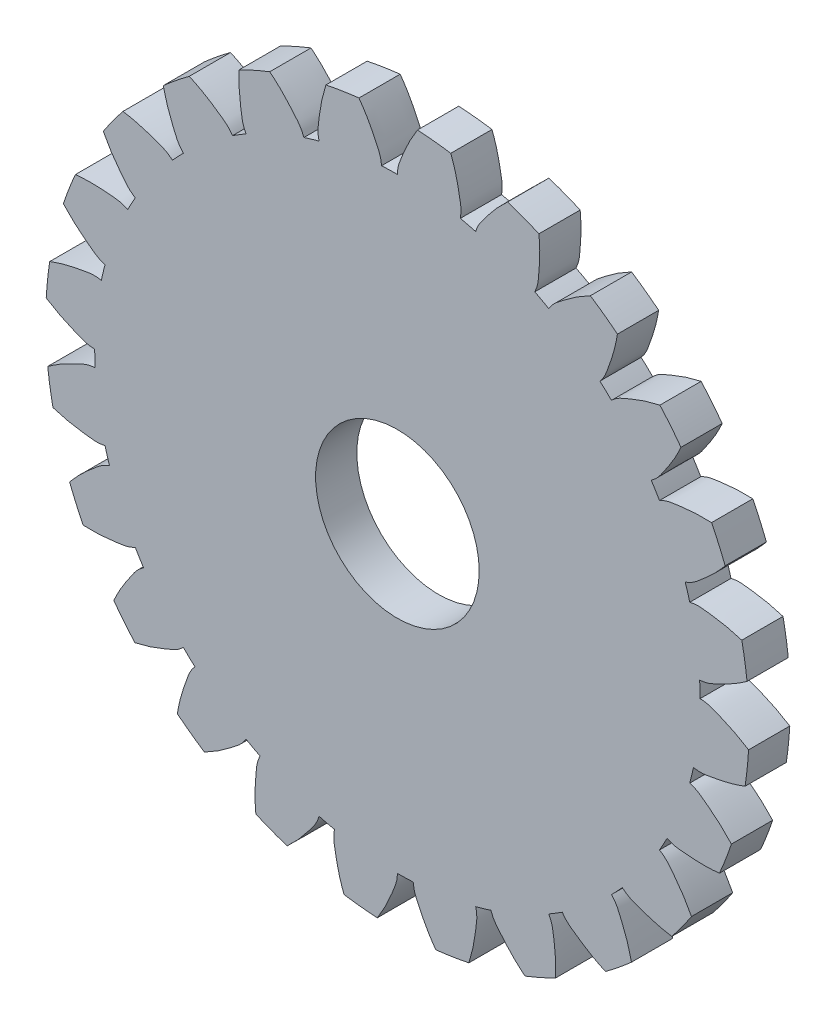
SolidWorks part; units mm, degrees
ref_plane "Front Plane" through (0, 0, 0) normal (0, 0, 1) x (1, 0, 0)
ref_plane "Top Plane" through (0, 0, 0) normal (0, 1, 0) x (1, 0, 0)
ref_plane "Right Plane" through (0, 0, 0) normal (1, 0, 0) x (0, 0, -1)
sketch "Sketch1" plane through (0, 0, 0) normal (0, 0, 1) x (1, 0, 0)
  line L0 (0, 0) -> (0, 11.7475) construction
  line L1 (6.5525, 9.7503) -> (0, 0) construction
  line L2 (0, 0) -> (2.0399, 11.569) construction
  line L3 (0.779, 13.6303) -> (6.5525, 9.7503) construction
  line L5 (0, 0) -> (1.8184, 17.3013) construction
  line L7 (2.0399, 11.569) -> (0.0138, 11.9263) construction
  line L10 (0, 0) -> (4.0179, 11.039) construction
  line L12 (0, 0) -> (5.8738, 10.1736) construction
  line L17 (4.0179, 11.039) -> (0.1751, 12.4377) construction
  line L19 (5.8738, 10.1736) -> (0.5505, 13.247) construction
  circle A0 centre (0, 0) radius 11.7475 construction
  circle A1 centre (0, 0) radius 12.7 construction
  circle A2 centre (0, 0) radius 13.6525 construction
  arc A3 (2.4424, 11.4908) -> (0, 11.7475) centre (0, 0) ccw
  arc A4 (0.779, 13.6303) -> (2.0719, 13.4944) centre (0, 0) cw
  spline S0 degree 3 poles (0, 11.7475) (0.0029, 11.8074) (0.0146, 12.0464) (0.2199, 12.5512) (0.4655, 13.1236) (0.7006, 13.5036) (0.779, 13.6303) knots 0 0 0 0 0.087308 0.348389 0.78275 1 1 1 1
  spline S1 degree 3 poles (2.4424, 11.4908) (2.452, 11.55) (2.4903, 11.7862) (2.3945, 12.3226) (2.2733, 12.9336) (2.1222, 13.3542) (2.0719, 13.4944) knots 0 0 0 0 0.087308 0.348389 0.78275 1 1 1 1
  dimension "D1" = 23.495
  dimension "D2" = 25.4
  dimension "D3" = 27.305
  dimension "D4" = 10
  dimension "D5" = 10
  dimension "D6" = 10
  dimension "D7" = 33.902
  dimension "D8" = 6
  dimension "D9" = 2.0574
  dimension "D10" = 4.0894
  dimension "D11" = 6.1468
  dimension "D12" = 6.9561
extrude "Extrude2" add sketch "Sketch1" along normal blind 1.6002
ref_axis "Axis1" through (0, 0, 14.9909) along (0, 0, -1)
sketch "Sketch2" plane through (0, 0, 0) normal (0, 0, 1) x (1, 0, 0)
  circle A0 centre (0, 0) radius 11.7475
extrude "Extrude3" add sketch "Sketch2" along normal blind 1.6002
pattern_circular "CirPattern1" count 24 over 360 about axis through (0, 0, 14.9909) along (0, 0, -1) of "Extrude2"
sketch "Sketch4" plane through (0, 0, 1.6002) normal (0, 0, 1) x (1, 0, 0)
  point P0 (0, 0)
sketch "Sketch5" plane through (0, 0, 1.6002) normal (0, 0, 1) x (1, 0, 0)
  circle A0 centre (0, 0) radius 3.175
  dimension "D1" = 6.35
extrude "Cut-Extrude1" cut sketch "Sketch5" against normal up to next
